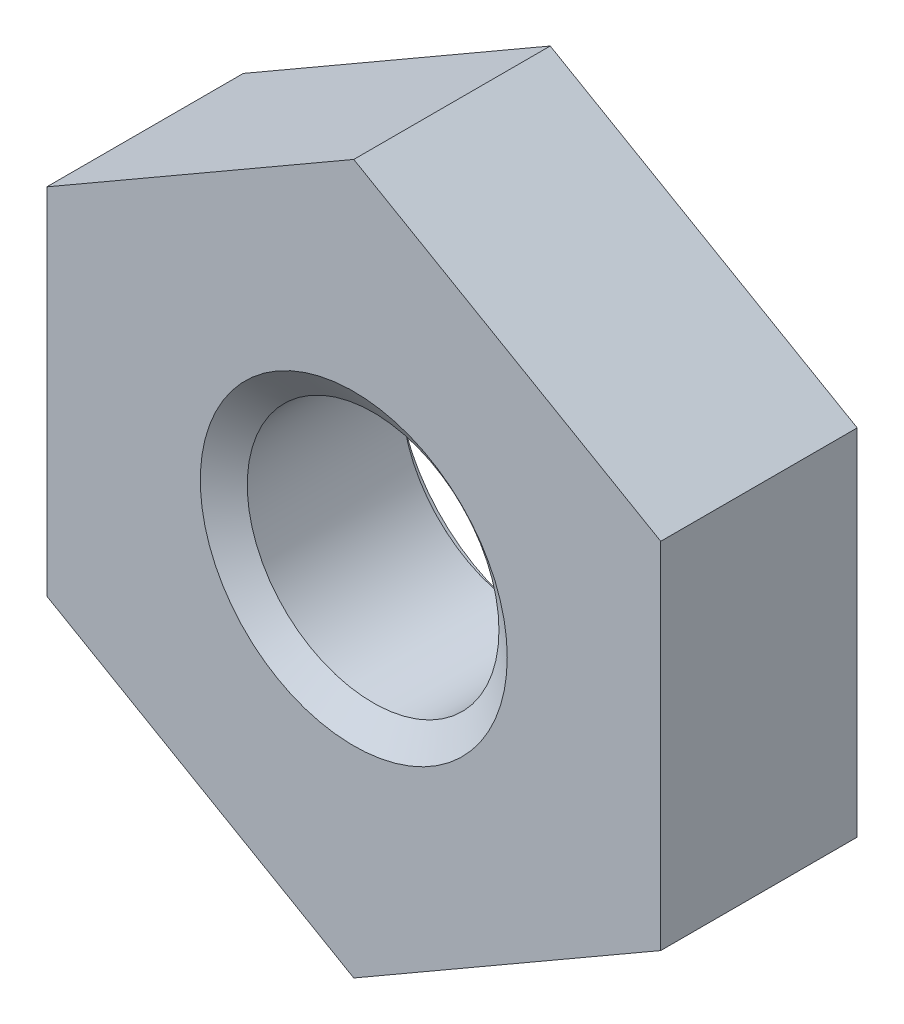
SolidWorks part; units mm, degrees
ref_plane "Plane1" through (0, 0, 0) normal (0, 0, 1) x (1, 0, 0)
ref_plane "Plane2" through (0, 0, 0) normal (0, 1, 0) x (1, 0, 0)
ref_plane "Plane3" through (0, 0, 0) normal (1, 0, 0) x (0, 0, -1)
revolve "EndChamfer" cut sketch "Sketch5"
sketch "Sketch5"
  line L0 (1.5746, 1.25) -> (1.4013, 1.0025)
  line L1 (1.6254, 1.25) -> (1.5746, 1.25)
  line L2 (1.6254, 1.25) -> (1.6254, 1.0025)
  line L3 (1.6254, 1.0025) -> (1.4013, 1.0025)
  line L6 (-0.0508, 1.25) -> (0, 1.25)
  line L7 (0, 1.25) -> (0.1733, 1.0025)
  line L9 (0.1733, 1.0025) -> (-0.0508, 1.0025)
  line L10 (-0.0508, 1.0025) -> (-0.0508, 1.25)
  line L11 (25.0375, 0) -> (38.388, 0) construction
  line L12 (1.6, 0) -> (0, 0) construction
extrude "BaseNut" add sketch "BaseNutSke" against normal blind 1.6
sketch "BaseNutSke" plane through (0, 0, 0) normal (0, 0, 1) x (1, 0, 0)
  line L6 (2.5, 1.4434) -> (2.5, -1.4434)
  line L7 (-2.5, 1.4434) -> (-2.5, -1.4434)
  line L8 (2.5, 1.4434) -> (0, 2.8868)
  line L9 (0, 2.8868) -> (-2.5, 1.4434)
  line L10 (-2.5, -1.4434) -> (0, -2.8868)
  line L11 (0, -2.8868) -> (2.5, -1.4434)
  circle A0 centre (0, 0) radius 1.025
  dimension "D4" = 2.5
  dimension "Tap_drill" = 2.05
  dimension "D1" = 120
  dimension "D2" = 2.5
  dimension "D3" = 2.5
  dimension "Width_flats" = 5
pattern_linear "ThdSchPat"
revolve "ThreadSchematic" cut sketch "ThdSchSke" angle 360 about L11
sketch "ThdSchSke" plane through (0, 0, 0) normal (0, 1, 0) x (1, 0, 0)
  line L0 (-1.25, 0.0254) -> (-1.025, 0.1829)
  line L1 (-1.025, 0.1829) -> (-0.5125, 0.1829)
  line L2 (-0.5125, 0.1829) -> (-0.5125, -0.1321)
  line L3 (-0.5125, -0.1321) -> (-1.025, -0.1321)
  line L4 (-1.025, -0.1321) -> (-1.25, 0.0254)
  line L5 (-3.175, 0.45) -> (3.175, 0.45) construction
  line L6 (0, 0.45) -> (0, -2.9874) construction
  line L7 (0, 1.4171) -> (0, 0.1575) construction
  dimension "D1" = 35
  dimension "VeeAngle" = 70
  dimension "SideAngle" = 55
  dimension "D2" = 0.0508
  dimension "OverCut" = 1.025
  dimension "Tap_Drill" = 2.05
  dimension "Advance" = 0.3873
  dimension "Thread_major" = 2.5
  dimension "Num_threads" = 5
  dimension "D4" = 50
  dimension "Offset1" = 1.6254
  dimension "ThreadMajor" = 1.25
  dimension "ChamferDepth" = 0.2475
  dimension "Offset2" = 1.6762
equation "\"D2@BaseNutSke\" = \"Width_flats@BaseNutSke\" / 2"
equation "\"D3@BaseNutSke\" = \"Width_flats@BaseNutSke\" / 2"
equation "\"D4@BaseNutSke\" = \"D3@BaseNutSke\""
equation "\"Thread_major@ThdSchSke\" = \"Thread_major@ThreadCosmetic\""
equation "\"Tap_drill@ThdSchSke\" = \"Tap_drill@BaseNutSke\""
equation "\"Overcut@ThdSchSke\" = \"Tap_drill@ThdSchSke\" * 0.5"
equation "\"Num_threads@ThdSchPat\" = int(  ( \"Thickness@BaseNut\" - 0.0508 ) / \"Advance@ThdSchSke\" + 0.999 )  + 1"
equation "\"Advance@ThdSchPat\" = ( \"Thickness@BaseNut\" - 0.0508 ) /  (\"Num_threads@ThdSchPat\" - 1) 'relax it"
equation "' \"Num_threads@ThdSchPat\" = \"Num_threads@ThdSchPat\" - sgn( \"Num_threads@ThdSchPat\" - 1) '---chamfered tips only---"
equation "\"ThreadMajor@Sketch5\" = \"Thread_major@ThreadCosmetic\" * 0.5"
equation "\"ChamferDepth@Sketch5\" = (\"Thread_major@ThreadCosmetic\" - \"Tap_drill@BaseNutSke\") * 0.55"
equation "\"Offset1@Sketch5\" = \"Thickness@BaseNut\" + 0.0254"
equation "\"Offset2@Sketch5\" = \"Offset1@Sketch5\" + 0.0508"
